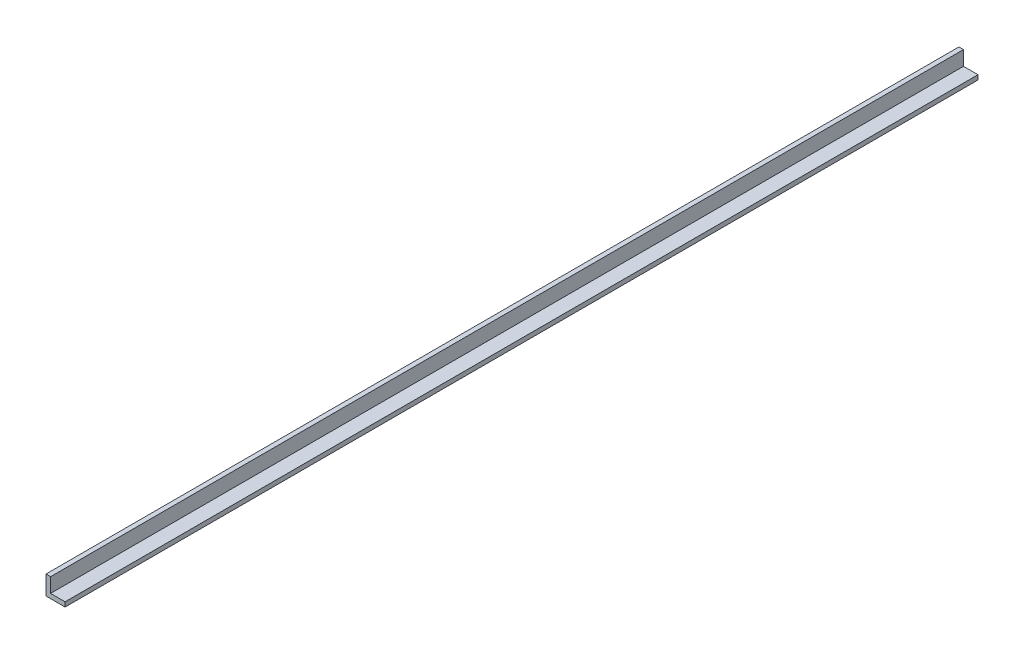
SolidWorks part; units mm, degrees
ref_plane "Plan de face" through (0, 0, 0) normal (0, 0, 1) x (1, 0, 0)
ref_plane "Plan de dessus" through (0, 0, 0) normal (0, 1, 0) x (1, 0, 0)
ref_plane "Plan de droite" through (0, 0, 0) normal (1, 0, 0) x (0, 0, -1)
sketch "Esquisse1" plane through (0, 0, 0) normal (0, 0, 1) x (1, 0, 0)
  line L0 (0, 0) -> (50, 0)
  line L2 (12, 12) -> (12, 50)
  line L3 (12, 50) -> (0, 50)
  line L4 (0, 0) -> (0, 50)
  line L7 (12, 12) -> (50, 12)
  line L8 (50, 0) -> (50, 12)
  dimension "D1" = 50
  dimension "D2" = 50
  dimension "D3" = 12
  dimension "D4" = 12
extrude "Boss.-Extru.1" add sketch "Esquisse1" along normal blind 2390
